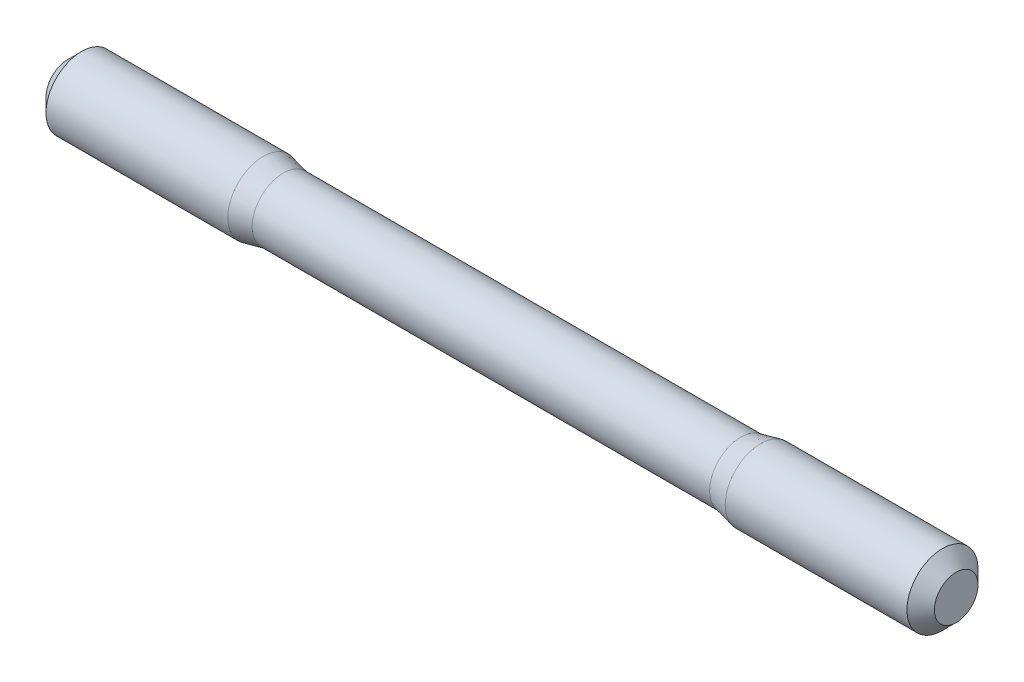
SolidWorks part; units mm, degrees
ref_plane "Front" through (0, 0, 0) normal (0, 0, 1) x (1, 0, 0)
ref_plane "Top" through (0, 0, 0) normal (0, 1, 0) x (1, 0, 0)
ref_plane "Right" through (0, 0, 0) normal (1, 0, 0) x (0, 0, -1)
other "Configuration Table"
sketch "Sketch1" plane through (0, 0, 0) normal (0, 0, 1) x (1, 0, 0)
  line L0 (-1.3108, 0) -> (30.3862, 0) construction
  line L1 (0, 0) -> (0, 4)
  line L2 (0, 4) -> (22, 4)
  line L3 (22, 4) -> (24.25, 3.5)
  line L4 (24.25, 3.5) -> (75.75, 3.5)
  line L5 (75.75, 3.5) -> (78, 4)
  line L6 (78, 4) -> (100, 4)
  line L7 (100, 4) -> (100, 0)
  line L8 (100, 0) -> (0, 0)
revolve "Base" add sketch "Sketch1" angle 360 about L0
chamfer "HeadChamfer" distance 1.5415 angle 45 2 edges at (0, 0, 4) (100, 0, 4)
sketch "Sketch2" plane through (0, 0, 0) normal (0, 0, 1) x (1, 0, 0)
  line L0 (98.4585, 2.665) -> (99.2292, 4)
  line L1 (99.2292, 4) -> (99.2292, 4.5)
  line L2 (99.2292, 4.5) -> (97.6877, 4.5)
  line L3 (97.6877, 4.5) -> (97.6877, 4)
  line L4 (97.6877, 4) -> (98.4585, 2.665)
  line L5 (0, 0) -> (114.8799, 0) construction
  line L6 (98.4585, 4) -> (98.4585, -4) construction
revolve "Cut-Revolve10" [suppressed] cut sketch "Sketch2" angle 360 about L5
pattern_linear "LPattern10" [suppressed] count 12 spacing 1.8498 along (1, 0, 0)
sketch "Sketch3" plane through (0, 0, 0) normal (0, 0, 1) x (1, 0, 0)
  line L0 (1.5415, 2.665) -> (2.3123, 4)
  line L1 (2.3123, 4) -> (2.3123, 4.5)
  line L2 (2.3123, 4.5) -> (0.7708, 4.5)
  line L3 (0.7708, 4.5) -> (0.7708, 4)
  line L4 (0.7708, 4) -> (1.5415, 2.665)
  line L5 (0, 0) -> (15.3216, 0) construction
  line L6 (0, 2.4585) -> (0, -2.4585) construction
  line L7 (1.5415, 4) -> (1.5415, -4) construction
revolve "Cut-Revolve11" [suppressed] cut sketch "Sketch3" angle 360 about L5
pattern_linear "LPattern11" [suppressed] count 4 spacing 1.8498 along (1, 0, 0)
equation "\"D2@Sketch1\" = \"X@Sketch1\""
equation "\"D2@ThreadCosmetic2\" = \"D2@ThreadCosmetic1\""
equation "\"b@ThreadCosmetic2\" = \"b@Sketch1\""
equation "\"D1@HeadChamfer\" =  ( \"d@Sketch1\" - \"D2@ThreadCosmetic1\" )  / 2"
equation "\"D1@Sketch1\" = \"b@Sketch1\""
equation "\"D5@Sketch2\" = \"d@Sketch1\""
equation "\"D4@Sketch2\" =  ( \"d@Sketch1\" - \"D2@ThreadCosmetic2\" )  / 2"
equation "\"D3@LPattern10\" = \"D4@Sketch2\" * 1.2"
equation "\"D1@LPattern10\" = \"b@ThreadCosmetic2\" / \"D3@LPattern10\""
equation "\"D3@Sketch3\" = \"d@Sketch1\""
equation "\"D5@Sketch3\"  =  ( \"d@Sketch1\" - \"D2@ThreadCosmetic1\" )  / 2"
equation "\"D3@LPattern11\" = \"D5@Sketch3\" * 1.2"
equation "\"D1@LPattern11\" = \"D1@ThreadCosmetic1\" / \"D3@LPattern11\""
